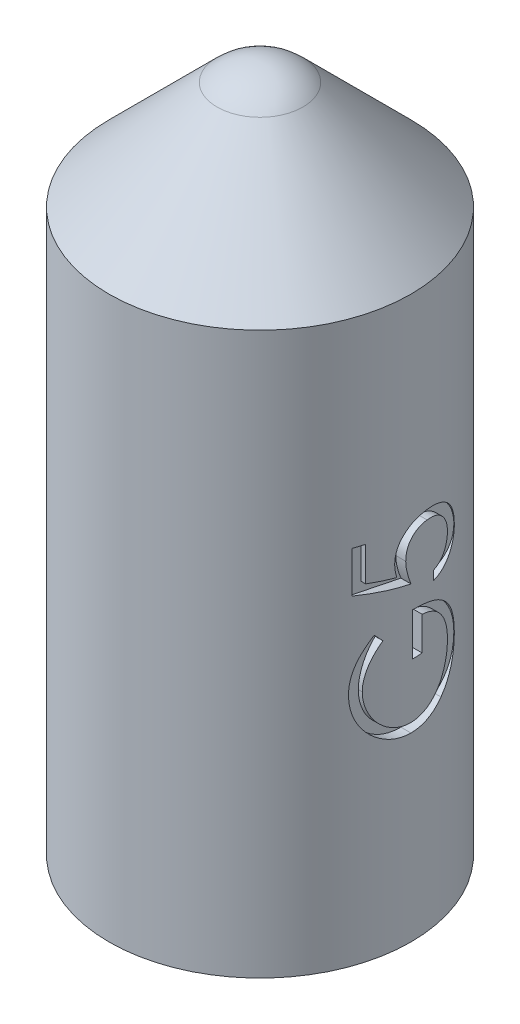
SolidWorks part; units mm, degrees
ref_plane "Plan de face" through (0, 0, 0) normal (0, 0, 1) x (1, 0, 0)
ref_plane "Plan de dessus" through (0, 0, 0) normal (0, 1, 0) x (1, 0, 0)
ref_plane "Plan de droite" through (0, 0, 0) normal (1, 0, 0) x (0, 0, -1)
sketch "Esquisse1" plane through (0, 0, 0) normal (0, 0, 1) x (1, 0, 0)
  line L0 (0, 0) -> (0, 61.7034) construction
  line L1 (-1.5, 5.75) -> (-1.5, 0.1754)
  line L2 (-1.5, 5.75) -> (0, 7.25) construction
  line L3 (-1, 6.25) -> (0, 6.25) construction
  line L4 (0, 0) -> (0, 7)
  line L5 (-1.5, 5.75) -> (-0.4268, 6.8232)
  arc A0 (-1.5, 0.1754) -> (0, 0) centre (0, 6.5) ccw
  arc A1 (0, 7) -> (-0.4268, 6.8232) centre (0, 6.3964) ccw
  dimension "D2" = 13
  dimension "D1" = 3
  dimension "D3" = 45
  dimension "D4" = 2
  dimension "D5" = 0.25
  dimension "D6" = 0.25
revolve "Révolution1" add sketch "Esquisse1" angle 360 about L0
ref_plane "Plan1" through (1.5, 0, 0) normal (1, 0, 0) x (0, 0, -1)
sketch "Esquisse2" plane through (1.5, 0, 0) normal (1, 0, 0) x (0, 0, -1)
  line L0 (0.5, 5.75) -> (0.5, 0.0193) construction
  line L1 (-1.5, 5.75) -> (1.5, 5.75) construction
  arc A0 (-1.5, 0.1754) -> (1.5, 0.1754) centre (0, 6.5) ccw construction
  text T0 "G5" font "Century Gothic" height 1
  dimension "D1" = 0.5
extrude "Enlèv. mat.-Extru.1" cut sketch "Esquisse2" against normal blind 0.1
ref_plane "Plan2" through (-1.5, 0, 0) normal (-1, 0, 0) x (0, 0, 1)
sketch "Esquisse3" plane through (-1.5, 0, 0) normal (-1, 0, 0) x (0, 0, 1)
  line L0 (0.5, 5.75) -> (0.5, -0.0004) construction
  line L1 (-1.5, 5.75) -> (1.5, 5.75) construction
  text T0 "G5" font "Century Gothic" height 1
  dimension "D1" = 0.5
extrude "Enlèv. mat.-Extru.2" cut sketch "Esquisse3" against normal offset from surface (0.1 mm away) 0.1
